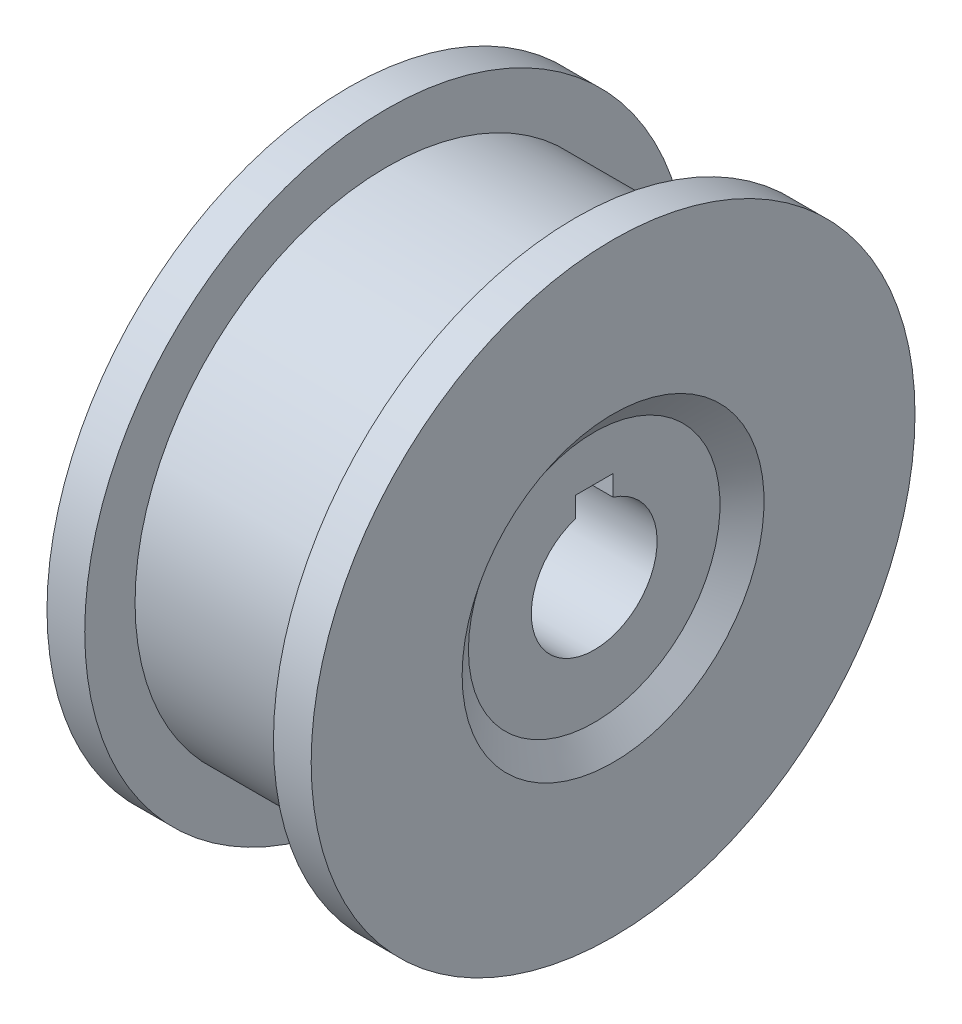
SolidWorks part; units mm, degrees
ref_plane "Plan de face" through (0, 0, 0) normal (0, 0, 1) x (1, 0, 0)
ref_plane "Plan de dessus" through (0, 0, 0) normal (0, 1, 0) x (1, 0, 0)
ref_plane "Plan de droite" through (0, 0, 0) normal (1, 0, 0) x (0, 0, -1)
sketch "Esquisse1" plane through (0, 0, 0) normal (0, 0, 1) x (1, 0, 0)
  line L0 (-9, 10) -> (-9, 5)
  line L1 (-10.5, 12) -> (-9, 10)
  line L2 (-10.5, 24) -> (-10.5, 12)
  line L3 (-7.5, 24) -> (-10.5, 24)
  line L4 (-7.5, 20) -> (-7.5, 24)
  line L5 (-7.5, 20) -> (7.5, 20)
  line L6 (7.5, 20) -> (7.5, 24)
  line L7 (7.5, 24) -> (10.5, 24)
  line L8 (10.5, 24) -> (10.5, 12)
  line L9 (10.5, 12) -> (9, 10)
  line L10 (9, 10) -> (9, 5)
  line L11 (9, 5) -> (-9, 5)
  line L12 (0, 0) -> (0, 30.7895) construction
  line L13 (0, 0) -> (22.6031, 0) construction
  point P1 (0, 5)
  point P17 (0, 20)
  dimension "D1" = 5
  dimension "D2" = 4
  dimension "D3" = 3
  dimension "D4" = 15
  dimension "D5" = 2
  dimension "D6" = 12
  dimension "D7" = 20
  dimension "D8" = 9
revolve "Révolution1" add sketch "Esquisse1" angle 360 about L13
sketch "Esquisse2" plane through (9, 0, 0) normal (1, 0, 0) x (0, 0, -1)
  line L1 (-1.5, 0) -> (1.5, 0)
  line L2 (-1.5, 0) -> (-1.5, 6.4)
  line L3 (-1.5, 6.4) -> (1.5, 6.4)
  line L4 (1.5, 0) -> (1.5, 6.4)
  dimension "D1" = 3
  dimension "D2" = 1.5
  dimension "D3" = 6.4
  dimension "D4" = 0
extrude "Enlèv. mat.-Extru.1" cut sketch "Esquisse2" against normal through all
